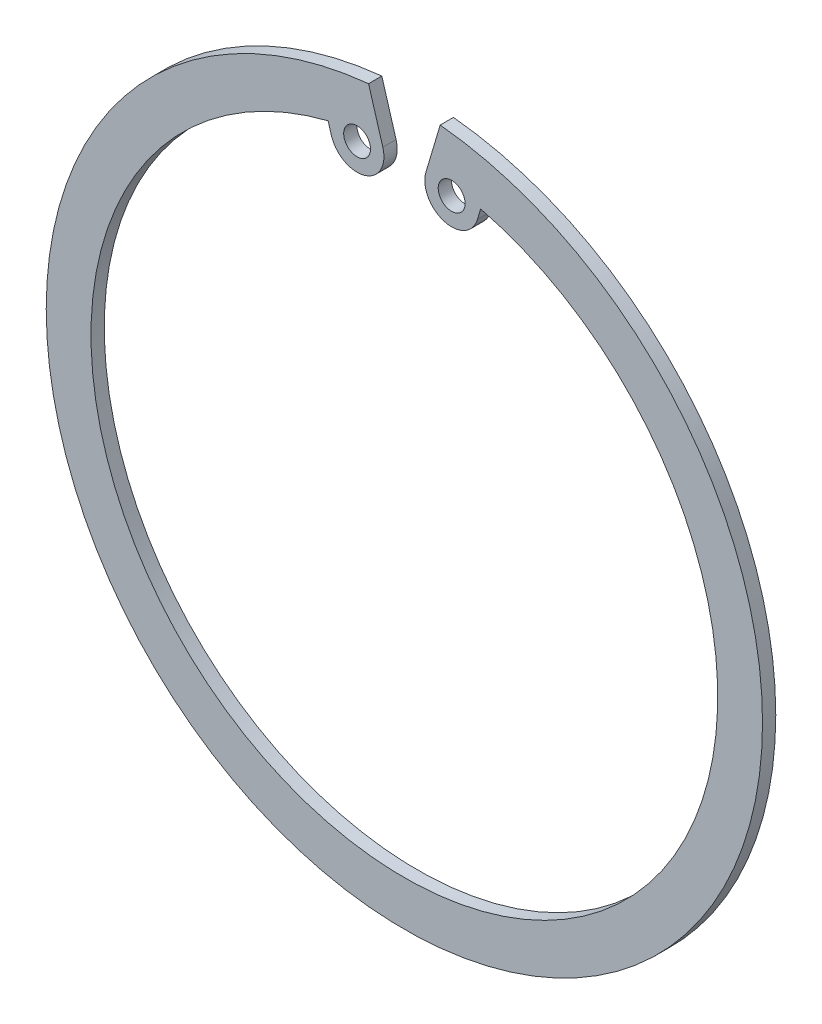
SolidWorks part; units mm, degrees
ref_plane "Plane1" through (0, 0, 0) normal (0, 0, 1) x (1, 0, 0)
ref_plane "Plane2" through (0, 0, 0) normal (0, 1, 0) x (1, 0, 0)
ref_plane "Plane3" through (0, 0, 0) normal (1, 0, 0) x (0, 0, -1)
sketch "Sketch1" plane through (0, 0, 0) normal (0, 0, 1) x (1, 0, 0)
  line L0 (2.4052, 34.4436) -> (4, 39.7995)
  line L1 (-8.5179, 33.9477) -> (-8.1556, 32.7313)
  line L2 (8.5179, 33.9477) -> (8.1556, 32.7313)
  line L3 (0, 0) -> (0, 66.3581) construction
  line L4 (-2.4052, 34.4436) -> (-4, 39.7995)
  arc A0 (-4, 39.7995) -> (4, 39.7995) centre (0, 0) ccw
  arc A1 (-8.5179, 33.9477) -> (8.5179, 33.9477) centre (0, 0) ccw
  arc A2 (-8.1556, 32.7313) -> (-2.4052, 34.4436) centre (-5.2804, 33.5875) ccw
  arc A3 (8.1556, 32.7313) -> (2.4052, 34.4436) centre (5.2804, 33.5875) cw
  circle A4 centre (5.2804, 33.5875) radius 1.5
  circle A5 centre (-5.2804, 33.5875) radius 1.5
  dimension "D1" = 40
  dimension "D2" = 35
  dimension "D4" = 1
  dimension "D3" = 3
  dimension "D6" = 3
  dimension "D5" = 33.164
  dimension "D7" = 8
extrude "Base-Extrude" add sketch "Sketch1" along normal blind 1.48
